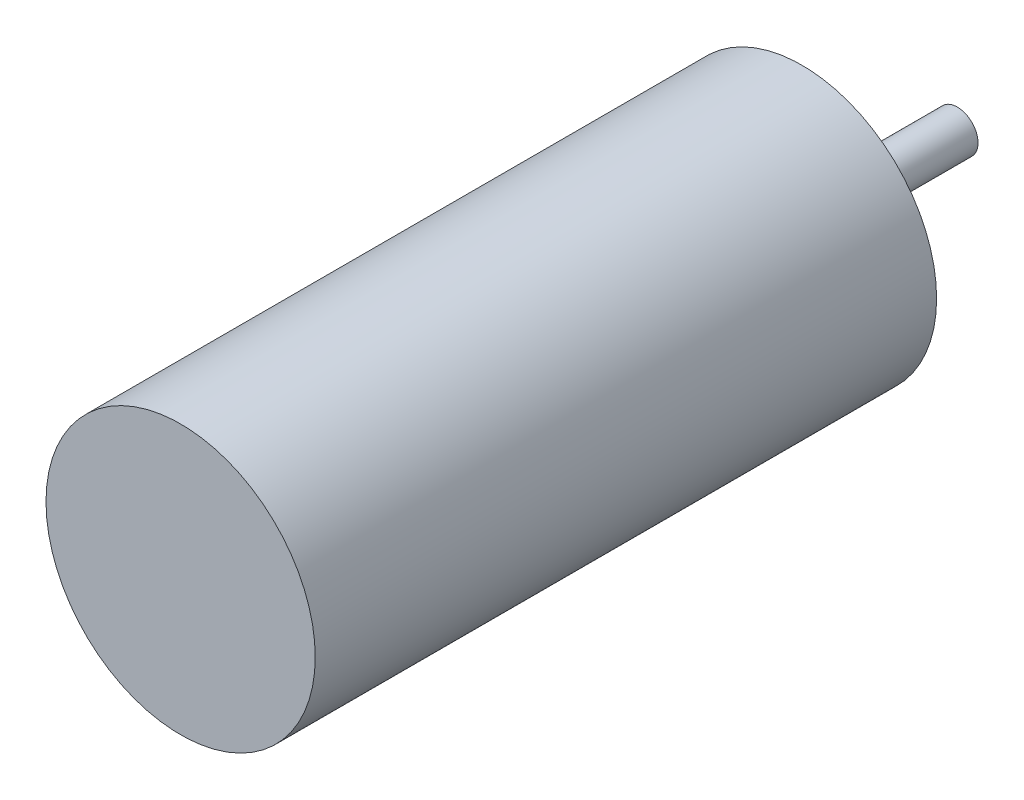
SolidWorks part; units mm, degrees
ref_plane "Alzado" through (0, 0, 0) normal (0, 0, 1) x (1, 0, 0)
ref_plane "Planta" through (0, 0, 0) normal (0, 1, 0) x (1, 0, 0)
ref_plane "Vista lateral" through (0, 0, 0) normal (1, 0, 0) x (0, 0, -1)
sketch "Croquis1" plane through (0, 0, 0) normal (0, 0, 1) x (1, 0, 0)
  circle A0 centre (0, 0) radius 13
  dimension "D1" = 26
extrude "Saliente-Extruir1" add sketch "Croquis1" along normal blind 60
sketch "Croquis2" plane through (0, 0, 0) normal (0, 0, -1) x (-1, 0, 0)
  circle A0 centre (0, 0) radius 2
  dimension "D1" = 4
extrude "Saliente-Extruir2" add sketch "Croquis2" along normal blind 15
sketch "Croquis3" plane through (0, 0, 0) normal (0, 0, -1) x (-1, 0, 0)
  line L0 (-9, 0) -> (9, 0) construction
  circle A0 centre (-9, 0) radius 1.5
  circle A1 centre (9, 0) radius 1.5
  point P6 (0, 0)
  dimension "D2" = 3
  dimension "D1" = 18
extrude "Cortar-Extruir1" cut sketch "Croquis3" against normal blind 7
